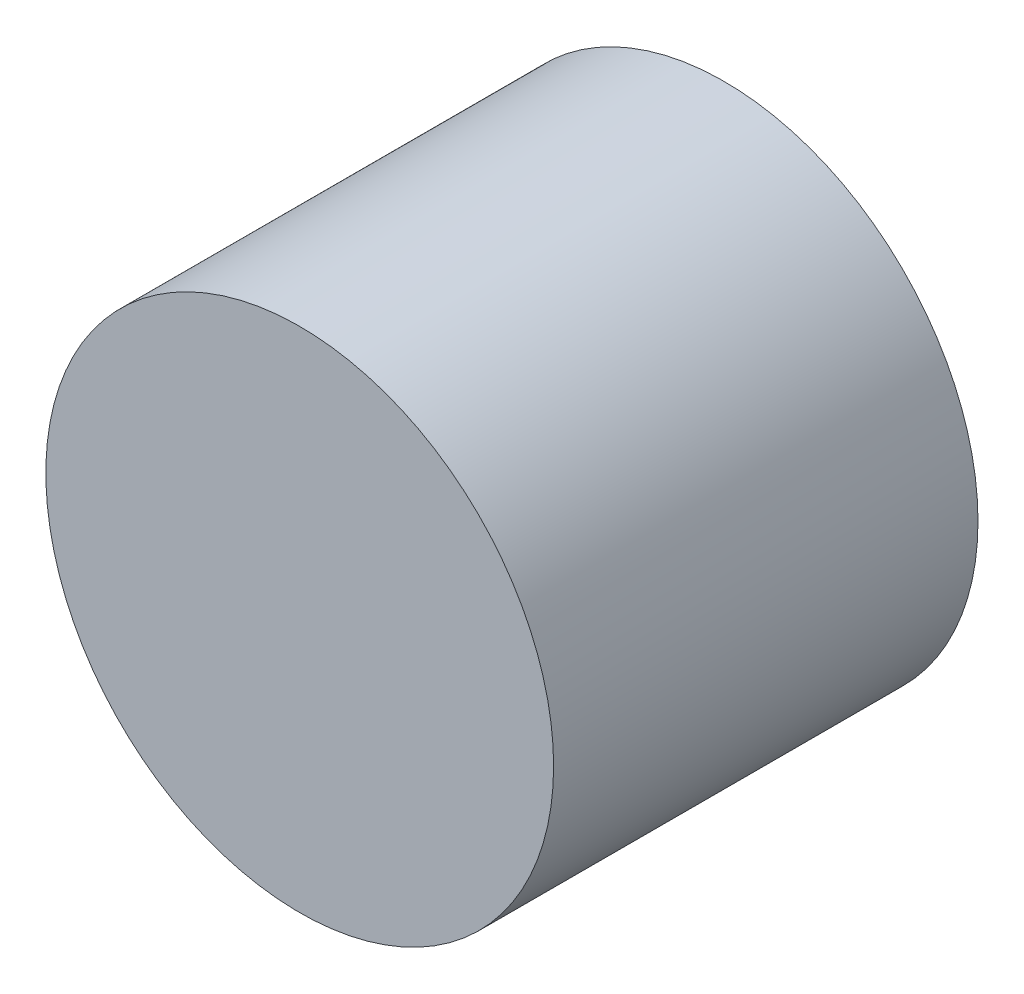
SolidWorks part; units mm, degrees
ref_plane "Plan de face" through (0, 0, 0) normal (0, 0, 1) x (1, 0, 0)
ref_plane "Plan de dessus" through (0, 0, 0) normal (0, 1, 0) x (1, 0, 0)
ref_plane "Plan de droite" through (0, 0, 0) normal (1, 0, 0) x (0, 0, -1)
sketch "Esquisse1" plane through (0, 0, 0) normal (0, 0, 1) x (1, 0, 0)
  line L0 (132, 33) -> (132, -33) construction
  circle A0 centre (132, 0) radius 7.7774
extrude "Boss.-Extru.1" add sketch "Esquisse1" against normal blind 15
sketch "Esquisse2" plane through (0, 0, 0) normal (0, 0, 1) x (1, 0, 0)
  circle A1 centre (132, 0) radius 7.7774
  circle A2 centre (132, 0) radius 7.7774
  dimension "D1" = 0
extrude "Enlèv. mat.-Extru.1" cut sketch "Esquisse2" against normal blind 2
